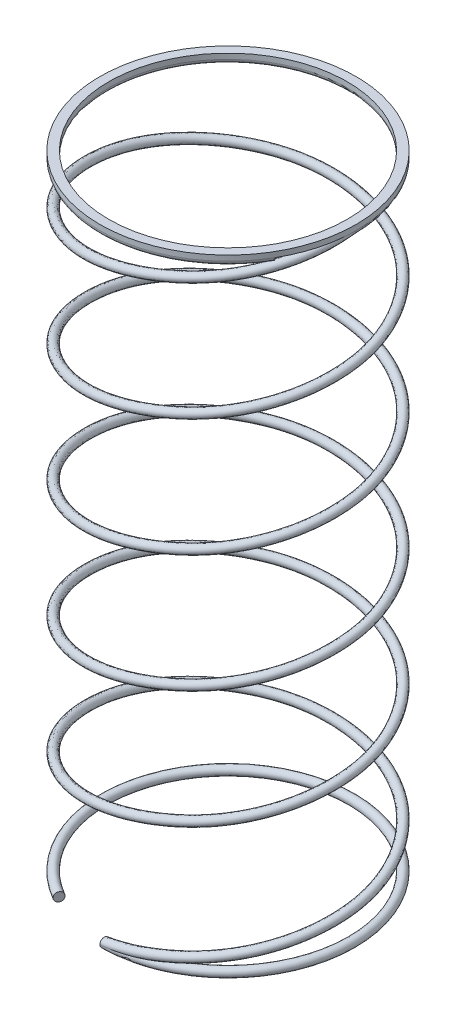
SolidWorks part; units mm, degrees
ref_plane "Front Plane" through (0, 0, 0) normal (0, 0, 1) x (1, 0, 0)
ref_plane "Top Plane" through (0, 0, 0) normal (0, 1, 0) x (1, 0, 0)
ref_plane "Right Plane" through (0, 0, 0) normal (1, 0, 0) x (0, 0, -1)
sketch "Croquis1" plane through (0, 0, 0) normal (0, 0, 1) x (1, 0, 0)
  line L0 (0, 0) -> (6.95, 0) construction
  circle A0 centre (6.95, 0) radius 0.25
  dimension "D1" = 6.7
  dimension "D2" = 0.5
sketch "Croquis2" plane through (0, 0, 0) normal (0, 0, 1) x (1, 0, 0)
  line L0 (0, 0) -> (0, -34.75)
  line L1 (0, -34.75) -> (-6.3246, -34.75) construction
sweep "Barrer1" add profiles "Croquis1" path "Croquis2" parameters "D1"=1890
sketch "Croquis3" plane through (0, 0, 0) normal (0, 0, -1) x (-1, 0, 0)
  line L0 (0, 0) -> (0, 1.8422) construction
  circle A1 centre (-6.95, 0) radius 0.25
  circle A2 centre (-6.95, 0) radius 0.25
  dimension "D1" = 0
revolve "Revolución1" add sketch "Croquis3" angle 330 about L0
fillet "Redondeo1" radius 0.2 1 edges at (7.2, 0, 0)
sketch "Croquis4" plane through (0, 0, 0) normal (-1, 0, 0) x (0, 0, 1)
  line L0 (0, -34.75) -> (0, -34.5851) construction
  circle A1 centre (6.95, -34.75) radius 0.25
  circle A2 centre (6.95, -34.75) radius 0.25
  dimension "D1" = 0
revolve "Revolución2" add sketch "Croquis4" angle 330 about L0
sketch "Sketch1" plane through (0, 0, 0) normal (0, 1, 0) x (1, 0, 0)
  circle A0 centre (0, 0) radius 6.7
  circle A1 centre (0, 0) radius 7.2
extrude "Boss-Extrude1" add sketch "Sketch1" along normal blind 0.3
